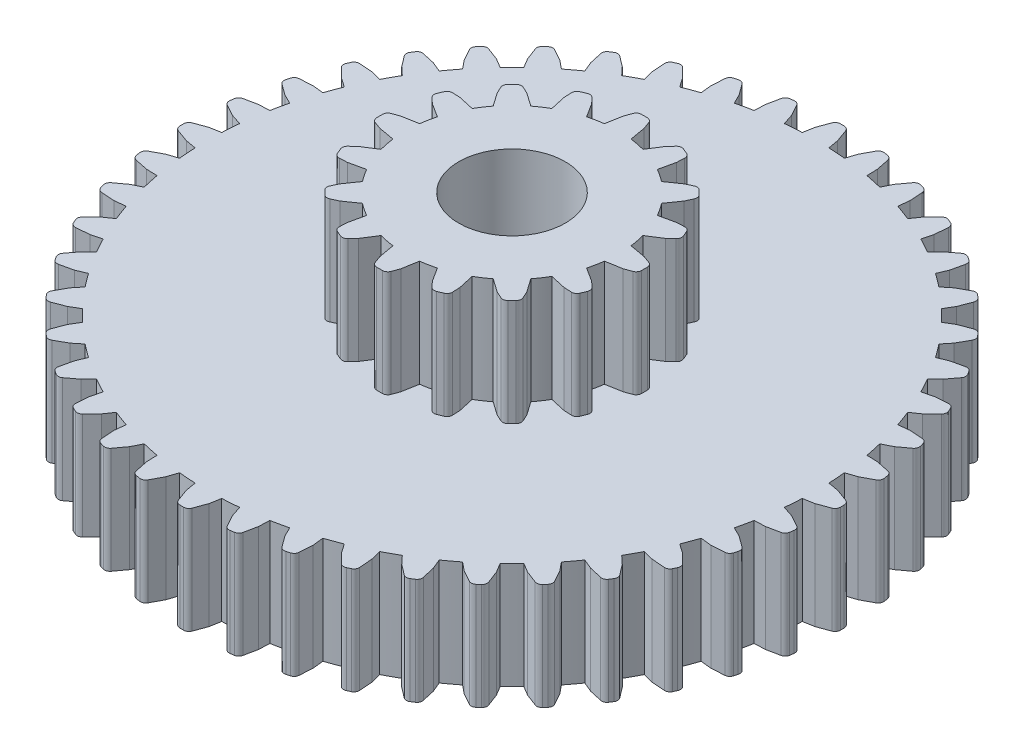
SolidWorks part; units mm, degrees
ref_plane "Front Plane" through (0, 0, 0) normal (0, 0, 1) x (1, 0, 0)
ref_plane "Top Plane" through (0, 0, 0) normal (0, 1, 0) x (1, 0, 0)
ref_plane "Right Plane" through (0, 0, 0) normal (1, 0, 0) x (0, 0, -1)
sketch "Sketch1" plane through (0, 0, 0) normal (0, 1, 0) x (1, 0, 0)
  circle A0 centre (0, 0) radius 72.4281
  circle A1 centre (0, 0) radius 12.7
  dimension "D1" = 25.4
  dimension "D2" = 144.8562
extrude "Boss-Extrude1" add sketch "Sketch1" along normal blind 25.4
sketch "Sketch2" plane through (0, 25.4, 0) normal (0, 1, 0) x (1, 0, 0)
  line L0 (-3.175, 72.3585) -> (3.175, 72.3585)
  line L1 (3.175, 72.3585) -> (2.7271, 74.8985)
  line L2 (2.7271, 74.8985) -> (1.3404, 78.7085)
  line L3 (1.3404, 78.7085) -> (-1.3404, 78.7085)
  line L4 (-1.3404, 78.7085) -> (-2.7271, 74.8985)
  line L5 (-2.7271, 74.8985) -> (-3.175, 72.3585)
  circle A0 centre (0, 0) radius 72.4281 construction
  dimension "D1" = 80
  dimension "D2" = 110
  dimension "D3" = 6.35
  dimension "D4" = 2.54
  dimension "D5" = 3.81
extrude "Boss-Extrude2" add sketch "Sketch2" against normal blind 25.4
fillet "Fillet1" radius 1.27 2 edges at (1.3404, 12.7, -78.7085) (-1.3404, 12.7, -78.7085)
pattern_circular "CirPattern1" count 44 over 360 about axis through (0, 0, 0) along (0, 1, 0) of "Fillet1", "Boss-Extrude2"
sketch "Sketch3" plane through (0, 25.4, 0) normal (0, 1, 0) x (1, 0, 0)
  circle A0 centre (0, 0) radius 25.4
  circle A1 centre (0, 0) radius 12.7
  circle A2 centre (0, 0) radius 12.7 construction
  dimension "D1" = 50.8
extrude "Boss-Extrude3" add sketch "Sketch3" along normal blind 25.4
sketch "Sketch4" plane through (0, 50.8, 0) normal (0, 1, 0) x (1, 0, 0)
  line L0 (-3.175, 25.2008) -> (3.175, 25.2008)
  line L1 (3.175, 25.2008) -> (2.5032, 29.0108)
  line L2 (2.5032, 29.0108) -> (1.8829, 30.7151)
  line L3 (0.6894, 31.5508) -> (-0.6894, 31.5508)
  line L4 (-1.8829, 30.7151) -> (-2.5032, 29.0108)
  line L5 (-2.5032, 29.0108) -> (-3.175, 25.2008)
  circle A0 centre (0, 0) radius 25.4 construction
  arc A1 (0.6894, 31.5508) -> (1.8829, 30.7151) centre (0.6894, 30.2808) cw
  arc A2 (-0.6894, 31.5508) -> (-1.8829, 30.7151) centre (-0.6894, 30.2808) ccw
  point P11 (1.5787, 31.5508)
  dimension "D6" = 1.27
  dimension "D1" = 80
  dimension "D2" = 110
  dimension "D3" = 3.81
  dimension "D4" = 2.54
  dimension "D5" = 6.35
extrude "Boss-Extrude4" add sketch "Sketch4" against normal blind 25.4
pattern_circular "CirPattern2" count 16 over 360 about axis through (0, 0, 0) along (0, 1, 0) of "Boss-Extrude4"
